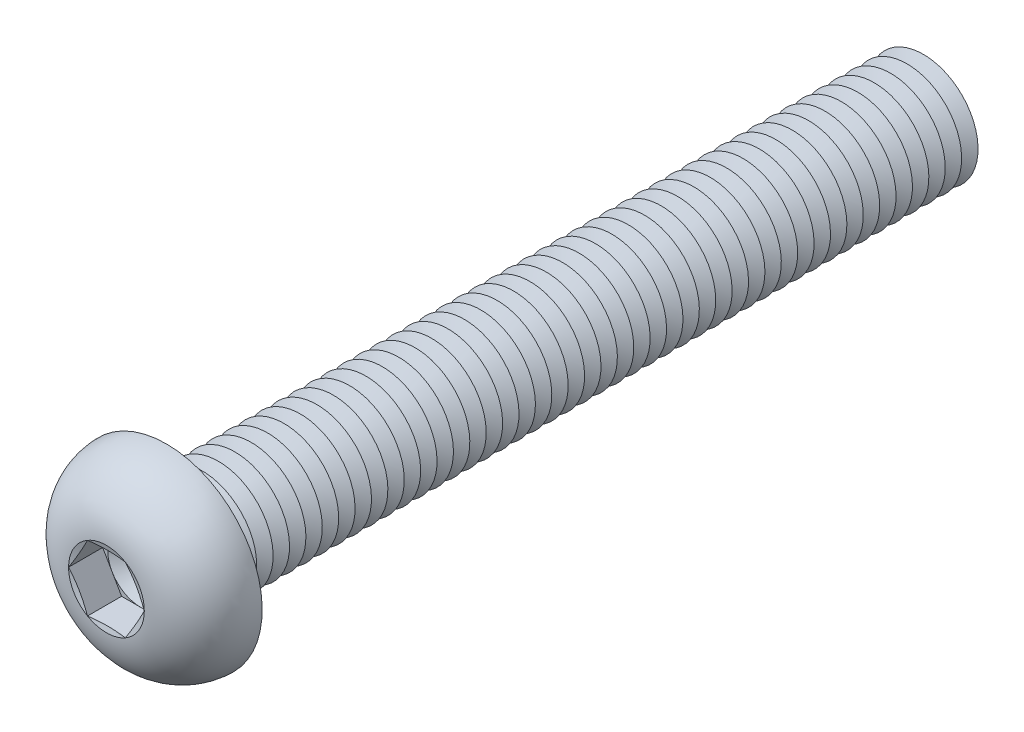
SolidWorks part; units mm, degrees
ref_plane "Front Plane" through (0, 0, 0) normal (0, 0, 1) x (1, 0, 0)
ref_plane "Top Plane" through (0, 0, 0) normal (0, 1, 0) x (1, 0, 0)
ref_plane "Right Plane" through (0, 0, 0) normal (1, 0, 0) x (0, 0, -1)
sketch "Sketch1" plane through (0, 0, 0) normal (1, 0, 0) x (0, 0, -1)
  line L0 (0, 5) -> (0, 8.75)
  line L3 (0, 5) -> (70, 5)
  line L4 (70, 5) -> (70, 0)
  line L5 (70, 0) -> (-5.5, 0) construction
  line L6 (-5.5, 0) -> (70, 0)
  line L7 (-5.5, 3.4641) -> (-5.5, 1.732) construction
  line L8 (-5.5, 1.732) -> (-5.5, 0)
  line L9 (-5.5, 3.4641) -> (-5.0359, 1.732)
  line L10 (-5.0359, 1.732) -> (-5.5, 1.732)
  line L11 (70, 0) -> (22.7481, 0) construction
  line L12 (0, 8.75) -> (-5.5, 8.75) construction
  arc A1 (0, 8.75) -> (-5.5, 3.4641) centre (0, 3.2457) ccw
  point P8 (70, 2.5)
  dimension "D1" = 17.5
  dimension "D2" = 10
  dimension "D3" = 5.5
  dimension "D4" = 6.9282
  dimension "D5" = 70
  dimension "D6" = 15
revolve "Revolve1" add sketch "Sketch1" angle 360 about L5
fillet "Fillet1" radius 0.75 1 edges at (0, 5, 0)
sketch "Sketch2" plane through (0, 0, 0) normal (1, 0, 0) x (0, 0, -1)
  line L0 (69.25, 5) -> (70.75, 5)
  line L1 (70, 5) -> (0.75, 5) construction
  line L2 (70.75, 5) -> (70, 3.701)
  line L3 (70, -5) -> (70, 5) construction
  line L4 (70, 3.701) -> (69.25, 5)
  dimension "D1" = 1.5
revolve "Cut-Revolve1" cut sketch "Sketch2" angle 360 about axis through (0, 0, -70) along (0, 0, -1)
pattern_linear "LPattern1" count 46 spacing 1.5 along (0, 0, 1) of "Cut-Revolve1"
sketch "Sketch3" plane through (0, 0, 5.5) normal (0, 0, 1) x (1, 0, 0)
  line L7 (1.732, 3) -> (-1.7321, 3)
  line L8 (-1.7321, 3) -> (-3.4641, 0)
  line L9 (-3.4641, 0) -> (-1.732, -3)
  line L10 (-1.732, -3) -> (1.732, -3)
  line L11 (1.732, -3) -> (3.4641, 0)
  line L12 (3.4641, 0) -> (1.732, 3)
  circle A0 centre (0, 0) radius 3 construction
  circle A3 centre (0, 0) radius 3.4641 construction
extrude "Cut-Extrude1" cut sketch "Sketch3" against normal blind 3.12
sketch "Sketch4" plane through (0, 0, 2.38) normal (0, 0, 1) x (1, 0, 0)
  line L1 (1.732, 3) -> (-1.7321, 3) construction
  circle A0 centre (0, 0) radius 3
extrude "Cut-Extrude2" cut sketch "Sketch4" against normal through all draft 60
